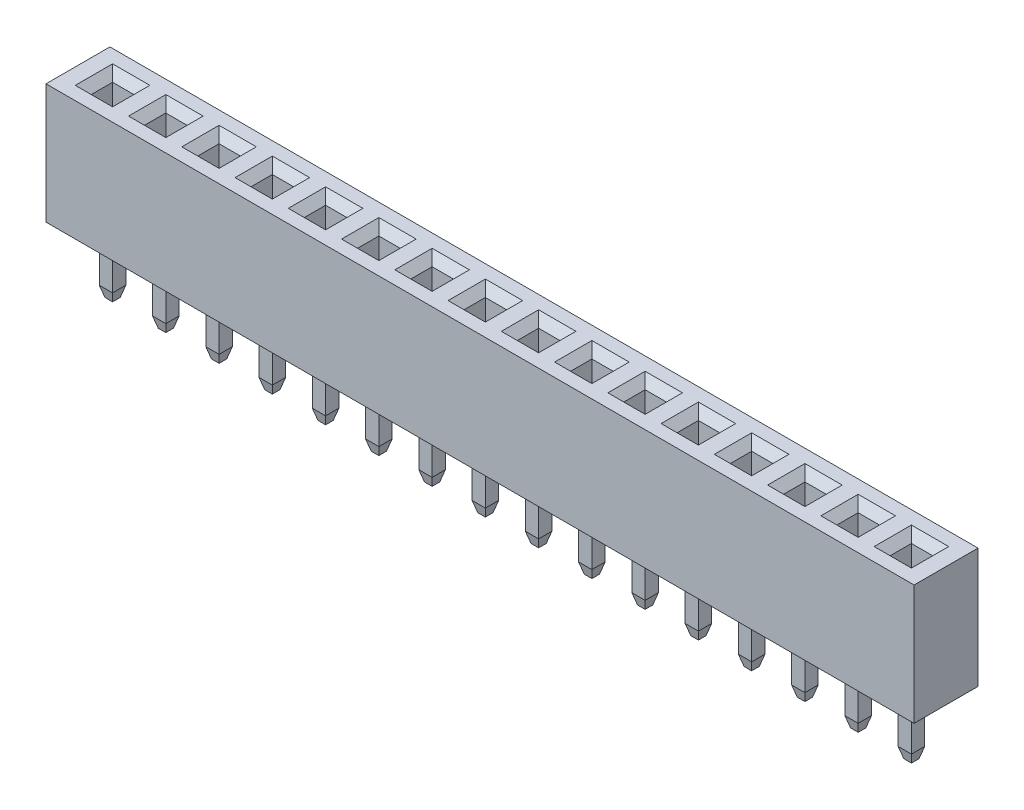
SolidWorks part; units mm, degrees
ref_plane "Front" through (0, 0, 0) normal (0, 0, 1) x (1, 0, 0)
ref_plane "Top" through (0, 0, 0) normal (0, 1, 0) x (1, 0, 0)
ref_plane "Right" through (0, 0, 0) normal (1, 0, 0) x (0, 0, -1)
sketch "Эскиз2" plane through (0, 0, 0) normal (0, 1, 0) x (1, 0, 0)
  line L1 (-1.3, 1.2) -> (1.3, 1.2)
  line L2 (-1.3, 1.2) -> (-1.3, -1.2)
  line L3 (-1.3, -1.2) -> (1.3, -1.2)
  line L4 (1.3, 1.2) -> (1.3, -1.2)
  line L8 (0, -1.2) -> (0, 1.2) construction
  dimension "D1" = 2.6
  dimension "D2" = 2.4
extrude "Вытянуть2" add sketch "Эскиз2" along normal blind 4.5
sketch "Эскиз3" plane through (0, 4.5, 0) normal (0, 1, 0) x (-1, 0, 0)
  line L0 (0, 0.4) -> (0, -0.4) construction
  line L1 (0.4, 0.4) -> (-0.4, 0.4)
  line L2 (0.4, 0.4) -> (0.4, -0.4)
  line L3 (0.4, -0.4) -> (-0.4, -0.4)
  line L4 (-0.4, 0.4) -> (-0.4, -0.4)
  dimension "D1" = 0.8
extrude "Вырез-Вытянуть1" cut sketch "Эскиз3" against normal blind 4
chamfer "Фаска3" distance 0.3 angle 45 4 edges at (-0.4, 4.5, 0) (0, 4.5, 0.4) (0.4, 4.5, 0) (0, 4.5, -0.4)
sketch "Эскиз1" plane through (0, 0, 0) normal (0, 1, 0) x (1, 0, 0)
  line L0 (-0.25, 0) -> (0.25, 0) construction
  line L1 (-0.25, 0.25) -> (0.25, 0.25)
  line L2 (-0.25, 0.25) -> (-0.25, -0.25)
  line L3 (-0.25, -0.25) -> (0.25, -0.25)
  line L4 (0.25, 0.25) -> (0.25, -0.25)
  dimension "D1" = 0.5
extrude "Вытянуть1" add sketch "Эскиз1" against normal blind 2.4
chamfer "Фаска1" distance 0.4 angle 15 4 edges at (0, -2.4, -0.25) (0.25, -2.4, 0) (0, -2.4, 0.25) (-0.25, -2.4, 0)
pattern_linear "Линейный массив1" count 16 spacing 2 along (-1, 0, 0) of "Вытянуть2", "Вырез-Вытянуть1", "Фаска3"
pattern_linear "Линейный массив3" count 100 spacing 2 along (-1, 0, 0) of "Вытянуть1", "Фаска1"
